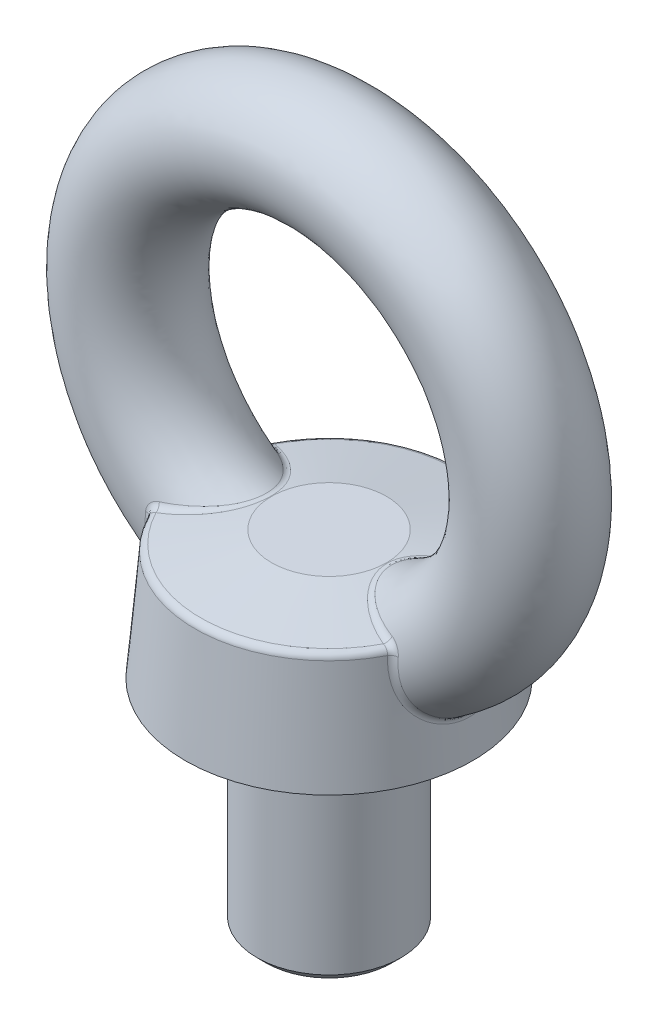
SolidWorks part; units mm, degrees
ref_plane "Front Plane" through (0, 0, 0) normal (0, 0, 1) x (1, 0, 0)
ref_plane "Top Plane" through (0, 0, 0) normal (0, 1, 0) x (1, 0, 0)
ref_plane "Right Plane" through (0, 0, 0) normal (1, 0, 0) x (0, 0, -1)
sketch "Sketch1" plane through (0, 0, 0) normal (0, 0, 1) x (1, 0, 0)
  ellipse E0 centre (0, 35.5) end of major axis (36, 35.5) minor radius 35.5
  dimension "D1" = 72
  dimension "D2" = 71
sketch "Sketch2" plane through (0, 0, 0) normal (1, 0, 0) x (0, 0, -1)
  line L3 (0, 71) -> (0, 0) construction
  circle A0 centre (0, 8) radius 8
  point P5 (0, 0)
sweep "Sweep1" add profiles "Sketch2" path "Sketch1"
sketch "Sketch3" plane through (0, 0, 0) normal (1, 0, 0) x (0, 0, -1)
  line L0 (0, 0) -> (-20, 0)
  line L1 (-20, 0) -> (-18.6002, 16)
  line L2 (-18.6002, 16) -> (-8, 17.8691)
  line L3 (-8, 17.8691) -> (0, 17.8691)
  line L4 (0, 17.8691) -> (0, 0)
revolve "Revolve1" add sketch "Sketch3" angle 360 about L4
fillet "Fillet1" radius 1 6 edges at (8.448, 17.784, 0.7667) (19.4891, 5.6894, 0.7149) (-8.448, 17.784, -0.7667) (-19.4891, 5.6894, -0.7149) (0, 16, -18.6002) (0, 16, 18.6002)
sketch "Sketch4" plane through (0, 0, 0) normal (0, -1, 0) x (1, 0, 0)
  circle A0 centre (0, 0) radius 10
  dimension "D1" = 20
extrude "Extrude1" add sketch "Sketch4" along normal blind 30
chamfer "Chamfer1" distance 1.25 angle 45 1 edges at (0, -30, -10)
sketch "Sketch5" plane through (0, 0, 0) normal (1, 0, 0) x (0, 0, -1)
  line L0 (-10, 0) -> (-10, -3.4151)
  line L1 (-10, 0) -> (-10, -28.75) construction
  line L2 (-8.75, -1.25) -> (-10, -3.4151)
  line L3 (-8.75, -1.25) -> (-8.75, -0.625)
  line L4 (-9.375, 0) -> (-10, 0)
  line L5 (-9.375, -0.625) -> (-8.75, -0.625) construction
  arc A1 (-8.75, -0.625) -> (-9.375, 0) centre (-9.375, -0.625) ccw
  point P0 (-8.75, -30)
  dimension "D1" = 30
revolve "Cut-Revolve1" cut sketch "Sketch5" angle 360 about axis through (0, -30, 0) along (0, 1, 0)
equation "\"D4@Sketch3\" = \"D1@Sketch2\""
equation "\"D5@Sketch3\" = \"D1@Sketch2\"/2"
